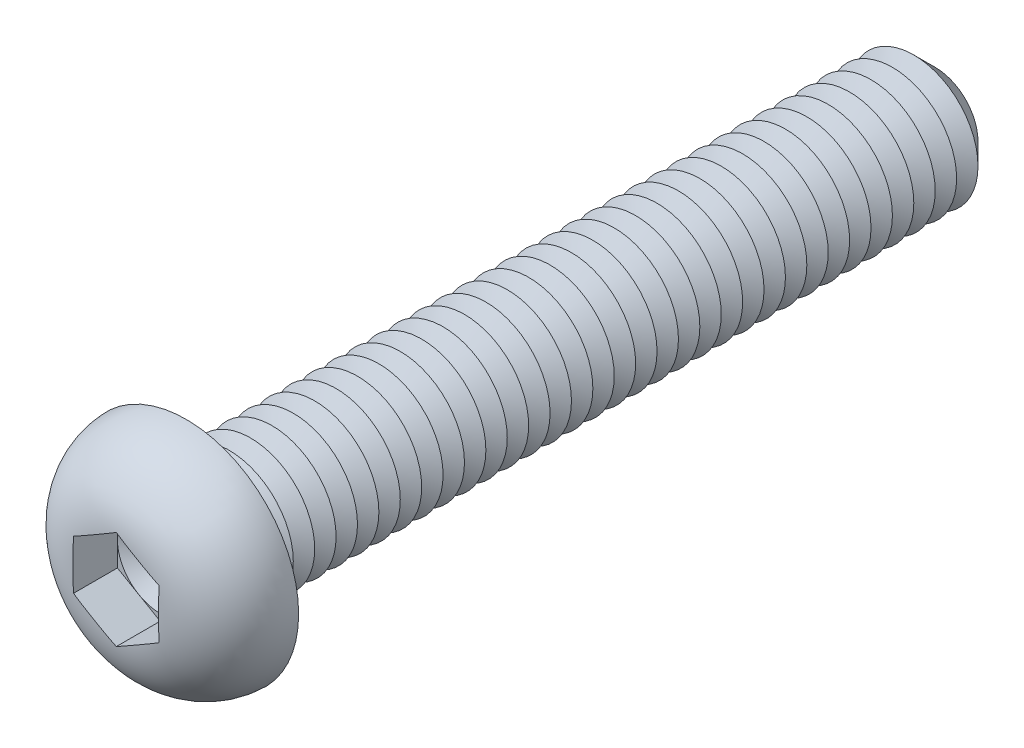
SolidWorks part; units mm, degrees
ref_plane "Front Plane" through (0, 0, 0) normal (0, 0, 1) x (1, 0, 0)
ref_plane "Top Plane" through (0, 0, 0) normal (0, 1, 0) x (1, 0, 0)
ref_plane "Right Plane" through (0, 0, 0) normal (1, 0, 0) x (0, 0, -1)
sketch "Sketch1" plane through (0, 0, 0) normal (1, 0, 0) x (0, 0, -1)
  line L0 (-47.9342, 0) -> (60.3146, 0) construction
sketch "Sketch2" plane through (0, 0, 0) normal (1, 0, 0) x (0, 0, -1)
  line L0 (0, 0) -> (-3.3, 0)
  line L1 (-47.9342, 0) -> (60.3146, 0) construction
  line L2 (-3.3, 0) -> (-3.3, 1.8515)
  line L3 (0, 5.25) -> (0, 0)
  arc A0 (-3.3, 1.8515) -> (0, 5.25) centre (0.1, 1.8515) cw
  dimension "D1" = 3.4
  dimension "D2" = 3.3
  dimension "D3" = 5.25
revolve "Revolve1" add sketch "Sketch2" angle 360 about L0
sketch "Sketch3" plane through (0, 0, 3.3) normal (0, 0, 1) x (1, 0, 0)
  line L1 (0, 2.3094) -> (-2, 1.1547)
  line L2 (-2, 1.1547) -> (-2, -1.1547)
  line L3 (-2, -1.1547) -> (0, -2.3094)
  line L4 (0, -2.3094) -> (2, -1.1547)
  line L5 (2, -1.1547) -> (2, 1.1547)
  line L6 (2, 1.1547) -> (0, 2.3094)
  circle A0 centre (0, 0) radius 2 construction
  dimension "D1" = 4
extrude "Cut-Extrude1" cut sketch "Sketch3" against normal blind 2.08
sketch "Sketch4" plane through (0, 0, 0) normal (0, 0, -1) x (-1, 0, 0)
  circle A0 centre (0, 0) radius 3
  dimension "D1" = 6
extrude "Boss-Extrude1" add sketch "Sketch4" along normal blind 35
chamfer "Chamfer1" distance 1 angle 45 1 edges at (-3, 0, -35)
sketch "Sketch5" plane through (0, 0, 0) normal (1, 0, 0) x (0, 0, -1)
  line L0 (1, 3) -> (2, 3)
  line L1 (34, 3) -> (0, 3) construction
  line L2 (2, 3) -> (1.5, 2.134)
  line L3 (1.5, 2.134) -> (1, 3)
  line L4 (0, -5.25) -> (0, 5.25) construction
  line L5 (34, 3) -> (0, 3) construction
  dimension "D1" = 1
  dimension "D2" = 1
revolve "Cut-Revolve1" cut sketch "Sketch5" angle 360 about L0
pattern_linear "LPattern1" count 33 spacing 1 along (0, 0, -1) of "Cut-Revolve1"
fillet "Fillet2" radius 0.5 1 edges at (-3, 0, 0)
sketch "Sketch6" plane through (0, 0, 1.22) normal (0, 0, 1) x (1, 0, 0)
  line L0 (0, -2.3094) -> (2, -1.1547) construction
  circle A0 centre (0, 0) radius 2
extrude "Cut-Extrude2" cut sketch "Sketch6" against normal through all draft 60
